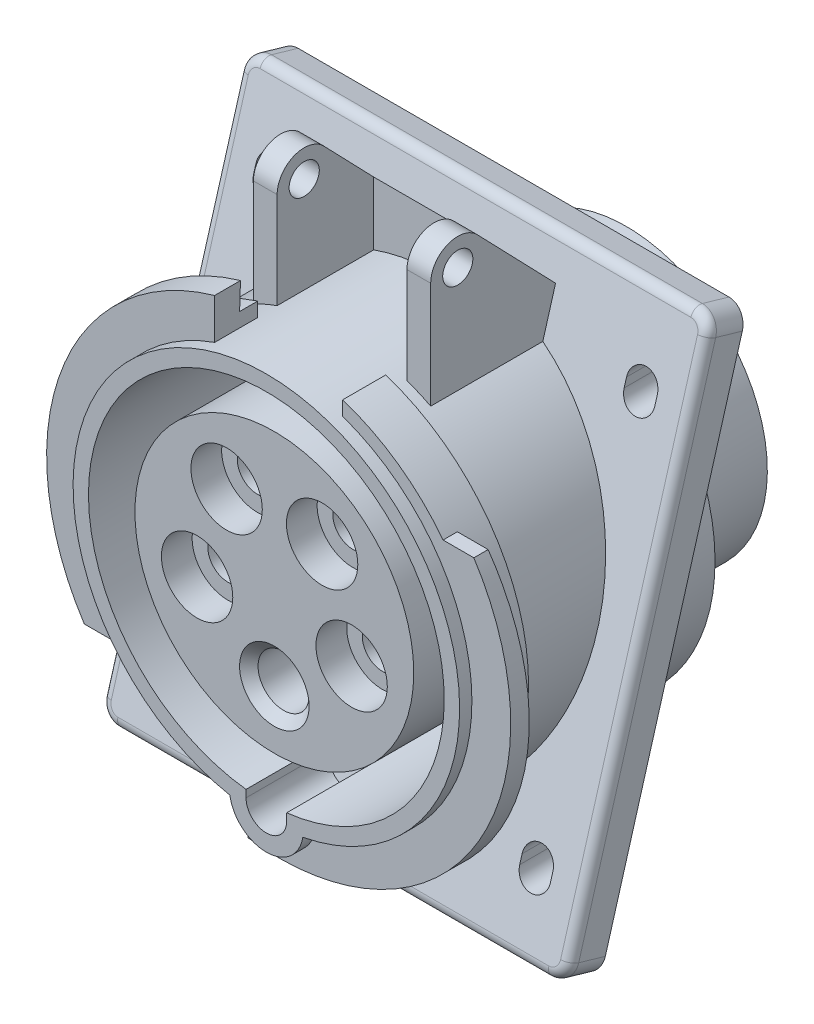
SolidWorks part; units mm, degrees
ref_plane "Спереди" through (0, 0, 0) normal (0, 0, 1) x (1, 0, 0)
ref_plane "Сверху" through (0, 0, 0) normal (0, 1, 0) x (1, 0, 0)
ref_plane "Справа" through (0, 0, 0) normal (1, 0, 0) x (0, 0, -1)
sketch "Эскиз1" plane through (0, 0, 0) normal (0, 0, 1) x (1, 0, 0)
  line L0 (-30.35, 30.35) -> (-30.35, -30.35) construction
  line L1 (-37.25, -37.25) -> (37.25, -37.25)
  line L2 (-37.25, -37.25) -> (-37.25, 37.25)
  line L3 (-37.25, 37.25) -> (37.25, 37.25)
  line L4 (37.25, -37.25) -> (37.25, 37.25)
  line L5 (-37.25, -37.25) -> (37.25, 37.25) construction
  line L6 (-37.25, 37.25) -> (37.25, -37.25) construction
  line L7 (-30.35, -30.35) -> (30.35, -30.35) construction
  line L8 (30.35, -30.35) -> (30.35, 30.35) construction
  line L9 (30.35, 30.35) -> (-30.35, 30.35) construction
  circle A0 centre (-30.35, 30.35) radius 2.4
  circle A1 centre (30.35, 30.35) radius 2.4
  circle A2 centre (30.35, -30.35) radius 2.4
  circle A3 centre (-30.35, -30.35) radius 2.4
  point P0 (0, 0)
  dimension "D3" = 4.8
  dimension "D1" = 74.5
  dimension "D2" = 74.5
  dimension "D4" = 60.7
extrude "Бобышка-Вытянуть1" add sketch "Эскиз1" along normal blind 9.8
sketch "Эскиз2" plane through (0, 0, 9.8) normal (0, 0, 1) x (1, 0, 0)
  circle A0 centre (0, 0) radius 31.4
  dimension "D1" = 62.8
extrude "Бобышка-Вытянуть2" add sketch "Эскиз2" along normal blind 40.7
sketch "Эскиз3" plane through (0, 0, 50.5) normal (0, 0, 1) x (1, 0, 0)
  circle A0 centre (0, 0) radius 28.9
  circle A1 centre (0, 0) radius 22.65
  dimension "D1" = 57.8
  dimension "D2" = 45.3
extrude "Вырез-Вытянуть1" cut sketch "Эскиз3" against normal blind 39
sketch "Эскиз4" plane through (0, 0, 50.5) normal (0, 0, 1) x (1, 0, 0)
  circle A0 centre (0, 0) radius 22.65
  dimension "D1" = 45.3
extrude "Вырез-Вытянуть2" cut sketch "Эскиз4" against normal blind 1.3
sketch "Эскиз5" plane through (0, 0, 49.2) normal (0, 0, 1) x (1, 0, 0)
  line L0 (0, 0) -> (0, -13.2) construction
  line L1 (12.5539, -4.079) -> (-12.5539, -4.079) construction
  line L2 (-7.7588, 10.679) -> (7.7588, 10.679) construction
  circle A0 centre (0, -13.2) radius 4.15
  circle A8 centre (-7.7588, 10.679) radius 5.8
  circle A9 centre (7.7588, 10.679) radius 5.8
  circle A10 centre (-12.5539, -4.079) radius 5.8
  circle A11 centre (12.5539, -4.079) radius 5.8
  point P15 (0, 0)
  dimension "D1" = 8.3
  dimension "D4" = 11.6
  dimension "D2" = 15.5175
  dimension "D3" = 13.2
  dimension "D5" = 14.758
  dimension "D7" = 7.7588
  dimension "D8" = 10.679
  dimension "D9" = 25.1079
  dimension "D10" = 12.5539
extrude "Вырез-Вытянуть3" cut sketch "Эскиз5" against normal blind 5
sketch "Эскиз6" plane through (0, 0, 44.2) normal (0, 0, 1) x (1, 0, 0)
  circle A0 centre (-7.7588, 10.679) radius 3.25
  circle A1 centre (7.7588, 10.679) radius 3.25
  circle A2 centre (-12.5539, -4.079) radius 3.25
  circle A3 centre (12.5539, -4.079) radius 3.25
  circle A4 centre (0, -13.2) radius 4.15
  dimension "D1" = 6.5
  dimension "D2" = 8.3
extrude "Вырез-Вытянуть4" cut sketch "Эскиз6" against normal blind 20
chamfer "Фаска1" distance 1.5 angle 45 1 edges at (4.15, -13.2, 49.2)
sketch "Эскиз7" plane through (0, 0, 9.8) normal (0, 0, 1) x (1, 0, 0)
  arc A0 (-5.9266, -30.8356) -> (5.9266, -30.8356) centre (0, -29.9) ccw
  circle A3 centre (0, 0) radius 31.4 construction
  circle A4 centre (0, 0) radius 31.4 construction
  arc A5 (-5.9266, -30.8356) -> (5.9266, -30.8356) centre (0, 0) ccw
  point P2 (0, -31.4)
  point P4 (0, -35.9)
  dimension "D1" = 12
  dimension "D2" = 4.5
  dimension "D3" = 11.8532
extrude "Бобышка-Вытянуть3" add sketch "Эскиз7" along normal up to surface (40.7 mm away)
sketch "Эскиз8" plane through (0, 0, 50.5) normal (0, 0, 1) x (1, 0, 0)
  line L0 (-3.3, -29.9) -> (-3.3, -28.711)
  line L1 (3.3, -29.9) -> (3.3, -28.711)
  circle A1 centre (0, 0) radius 28.9 construction
  arc A2 (-3.2596, -30.4146) -> (3.2596, -30.4146) centre (0, -29.9) ccw
  arc A3 (-3.3, -29.9) -> (3.3, -29.9) centre (0, -29.9) ccw
  arc A4 (-3.3, -28.711) -> (3.3, -28.711) centre (0, 0) ccw
  dimension "D1" = 2.7
extrude "Вырез-Вытянуть5" cut sketch "Эскиз8" against normal up to surface (39 mm away)
ref_plane "Плоскость1" through (0, 0, 48.5) normal (0, 0, 1) x (1, 0, 0)
sketch "Эскиз9" plane through (0, 0, 48.5) normal (0, 0, 1) x (1, 0, 0)
  circle A0 centre (0, 0) radius 37.7
  arc A1 (-5.9266, -30.8356) -> (5.9266, -30.8356) centre (0, -29.9) ccw construction
  arc A2 (5.9266, -30.8356) -> (-5.9266, -30.8356) centre (0, 0) ccw construction
  arc A3 (-5.9266, -30.8356) -> (5.9266, -30.8356) centre (0, -29.9) ccw
  arc A4 (5.9266, -30.8356) -> (-5.9266, -30.8356) centre (0, 0) ccw
  dimension "D1" = 75.4
extrude "Бобышка-Вытянуть4" add sketch "Эскиз9" against normal blind 4.3
sketch "Эскиз10" plane through (0, 0, 44.2) normal (0, 0, -1) x (-1, 0, 0)
  line L0 (-3.3, -29.9) -> (-3.3, -28.711) construction
  line L1 (3.3, -28.711) -> (3.3, -29.9) construction
  line L2 (-3.3, -29.9) -> (-3.3, -28.711)
  line L3 (3.3, -28.711) -> (3.3, -29.9)
  circle A0 centre (0, 0) radius 33.6
  arc A1 (3.3, -28.711) -> (-3.3, -28.711) centre (0, 0) ccw
  arc A2 (-3.3, -29.9) -> (3.3, -29.9) centre (0, -29.9) ccw construction
  arc A3 (-3.3, -29.9) -> (3.3, -29.9) centre (0, -29.9) ccw
  dimension "D1" = 67.2
extrude "Бобышка-Вытянуть5" add sketch "Эскиз10" along normal blind 2.7
sketch "Эскиз11" plane through (0, 0, 48.5) normal (0, 0, 1) x (1, 0, 0)
  line L0 (-10.4, 36.2371) -> (-10.4, 29.6277)
  line L1 (-4.9932, -33.2269) -> (-4.9932, -37.3679)
  line L2 (-10.4, 39.443) -> (10.4, 39.443) construction
  line L3 (26.7136, 20.3799) -> (31.7167, 20.3799)
  line L4 (10.4, 31.95) -> (10.4, 29.6277)
  line L5 (-26.5589, -20.5811) -> (-31.5865, -20.5811)
  arc A0 (5.9266, -30.8356) -> (-5.9266, -30.8356) centre (0, 0) ccw construction
  arc A1 (5.9266, -30.8356) -> (-5.9266, -30.8356) centre (0, 0) ccw construction
  circle A2 centre (0, 0) radius 37.7 construction
  arc A4 (10.4, 29.6277) -> (-10.4, 29.6277) centre (0, 0) ccw
  arc A5 (4.9932, -33.2269) -> (-4.9932, -33.2269) centre (0, 0) ccw construction
  arc A6 (26.7136, 20.3799) -> (10.4, 31.95) centre (0, 0) ccw
  arc A7 (-26.5589, -20.5811) -> (-4.9932, -33.2269) centre (0, 0) ccw
  arc A8 (-31.5865, -20.5811) -> (-4.9932, -37.3679) centre (0, 0) ccw
  arc A9 (31.7167, 20.3799) -> (-10.4, 36.2371) centre (0, 0) ccw
  point P10 (0, 39.443)
  dimension "D1" = 20.8
  dimension "D2" = 20
  dimension "D3" = 10.4
  dimension "D4" = 25
extrude "Вырез-Вытянуть6" cut sketch "Эскиз11" against normal up to next
sketch "Эскиз12" plane through (0, 0, 44.2) normal (0, 0, -1) x (-1, 0, 0)
  line L0 (0, -37.7) -> (0, -35.9)
  line L1 (4.9932, -33.2269) -> (4.9932, -37.3679) construction
  line L2 (4.9932, -33.2269) -> (4.9932, -37.3679)
  arc A0 (-31.7167, 20.3799) -> (4.9932, -37.3679) centre (0, 0) ccw construction
  arc A1 (-4.9932, -33.2269) -> (4.9932, -33.2269) centre (0, -29.9) ccw construction
  arc A2 (0, -37.7) -> (4.9932, -37.3679) centre (0, 0) ccw
  arc A3 (0, -35.9) -> (4.9932, -33.2269) centre (0, -29.9) ccw
extrude "Вырез-Вытянуть7" cut sketch "Эскиз12" against normal blind 2.3
sketch "Эскиз13" plane through (0, 0, 44.2) normal (0, 0, -1) x (-1, 0, 0)
  line L0 (0, -37.7) -> (0, -35.9)
  line L1 (-2, -37.6469) -> (-2, -35.5569)
  arc A0 (-4.9932, -33.2269) -> (0, -35.9) centre (0, -29.9) ccw construction
  arc A1 (-2, -35.5569) -> (0, -35.9) centre (0, -29.9) ccw
  arc A2 (-31.7167, 20.3799) -> (0, -37.7) centre (0, 0) ccw construction
  arc A3 (-2, -37.6469) -> (0, -37.7) centre (0, 0) ccw
  dimension "D1" = 2
extrude "Бобышка-Вытянуть6" add sketch "Эскиз13" along normal blind 2.5
sketch "Эскиз14" plane through (0, 0, 0) normal (0, 0, -1) x (-1, 0, 0)
  circle A0 centre (0, 0) radius 25.95
  dimension "D1" = 51.9
extrude "Вырез-Вытянуть8" cut sketch "Эскиз14" against normal blind 9.3
fillet "Скругление1" radius 3 4 edges at (37.25, -37.25, 4.9) (-37.25, -37.25, 4.9) (37.25, 37.25, 4.9) (-37.25, 37.25, 4.9)
fillet "Скругление2" radius 1.5 8 edges at (-36.3713, 36.3713, 9.8) (0, 37.25, 9.8) (36.3713, 36.3713, 9.8) (37.25, 0, 9.8) (36.3713, -36.3713, 9.8) (0, -37.25, 9.8) (-36.3713, -36.3713, 9.8) (-37.25, 0, 9.8)
ref_plane "Плоскость2" through (0, 0, 0) normal (-1, 0, 0) x (0, 0, 1)
sketch "Эскиз16" plane through (0, 0, 0) normal (-1, 0, 0) x (0, 0, 1)
  line L0 (2.8964, 49.6) -> (40.8362, 49.6) construction
  line L1 (50.5, 31.4) -> (9.8, 31.4) construction
  line L2 (38.2, 27.9) -> (38.2, 45.2)
  line L3 (41.5, 31.95) -> (41.5, -33.2269) construction
  line L4 (11, 27.9) -> (30.6331, 48.2546)
  line L5 (11, 27.9) -> (38.2, 27.9)
  line L6 (9.8, -30.8356) -> (9.8, 31.4) construction
  arc A0 (38.2, 45.2) -> (30.6331, 48.2546) centre (33.8, 45.2) ccw
  circle A1 centre (33.8, 45.2) radius 2.45
  dimension "D3" = 8.8
  dimension "D6" = 4.9
  dimension "D1" = 18.2
  dimension "D2" = 3.3
  dimension "D4" = 21.7
  dimension "D5" = 1.2
extrude "Бобышка-Вытянуть8" add sketch "Эскиз16" along normal mid plane 28.8
ref_plane "Плоскость3" through (0, 49.6, 0) normal (0, 1, 0) x (1, 0, 0)
sketch "Эскиз19" plane through (0, 49.6, 0) normal (0, 1, 0) x (1, 0, 0)
  line L0 (-10.55, -38.2) -> (10.55, -38.2)
  line L1 (-14.4, -38.2) -> (14.4, -38.2) construction
  line L2 (10.55, -38.2) -> (10.55, -22.5)
  line L3 (10.55, -22.5) -> (-10.55, -22.5)
  line L4 (-10.55, -22.5) -> (-10.55, -38.2)
  line L5 (0, 4.565) -> (0, -4.565) construction
  point P4 (0, -22.5)
  dimension "D1" = 21.1
  dimension "D2" = 15.7
extrude "Вырез-Вытянуть9" cut sketch "Эскиз19" against normal up to surface (20.0254 mm away)
ref_plane "Плоскость6" through (0, 0.364, 10.9739) normal (0, -0.0332, -0.9995) x (-1, 0, 0)
ref_plane "Плоскость7" through (0, 1.5079, 45.4549) normal (0, 0.0332, 0.9995) x (1, 0, 0)
sketch "Эскиз29" plane through (0, 0, 44.2) normal (0, 0, -1) x (-1, 0, 0)
  line L2 (10.4, 36.2371) -> (10.4, 31.95)
  line L3 (26.5589, -20.5811) -> (31.5865, -20.5811)
  line L4 (10.4, 36.2371) -> (10.4, 31.95)
  line L5 (26.5589, -20.5811) -> (31.5865, -20.5811)
  arc A2 (31.5865, -20.5811) -> (10.4, 36.2371) centre (0, 0) ccw
  arc A3 (26.5589, -20.5811) -> (10.4, 31.95) centre (0, 0) ccw
  arc A4 (31.5865, -20.5811) -> (10.4, 36.2371) centre (0, 0) ccw
  arc A5 (26.5589, -20.5811) -> (10.4, 31.95) centre (0, 0) ccw
  dimension "D1" = 0
extrude "Вырез-Вытянуть15" cut sketch "Эскиз29" against normal up to surface (1.9877 mm away)
ref_plane "Плоскость8" through (0, -0.364, 10.9739) normal (0, -0.0332, 0.9995) x (1, 0, 0)
ref_plane "Плоскость9" through (0, -1.5079, 45.4549) normal (0, -0.0332, 0.9995) x (1, 0, 0)
sketch "Эскиз30" plane through (0, 0, 44.2) normal (0, 0, -1) x (-1, 0, 0)
  line L2 (-2, -37.6469) -> (-2, -35.5569)
  line L3 (-26.7136, 20.3799) -> (-31.7167, 20.3799)
  line L4 (-2, -37.6469) -> (-2, -35.5569)
  line L5 (-26.7136, 20.3799) -> (-31.7167, 20.3799)
  arc A3 (-4.9932, -33.2269) -> (-2, -35.5569) centre (0, -29.9) ccw
  arc A4 (-26.7136, 20.3799) -> (-4.9932, -33.2269) centre (0, 0) ccw
  arc A5 (-31.7167, 20.3799) -> (-2, -37.6469) centre (0, 0) ccw
  arc A6 (-4.9932, -33.2269) -> (-2, -35.5569) centre (0, -29.9) ccw
  arc A7 (-26.7136, 20.3799) -> (-4.9932, -33.2269) centre (0, 0) ccw
  arc A8 (-31.7167, 20.3799) -> (-2, -37.6469) centre (0, 0) ccw
  dimension "D1" = 0
extrude "Вырез-Вытянуть16" cut sketch "Эскиз30" against normal up to surface (1.981 mm away)
ref_plane "Плоскость10" through (0, 5.3843, 18.5933) normal (0, 0.2782, 0.9605) x (-1, 0, 0)
ref_plane "Плоскость12" through (0, 0, 0) normal (1, 0, 0) x (0, 0, -1)
sketch "Эскиз34" plane through (0, 0, 0) normal (1, 0, 0) x (0, 0, -1)
  line L0 (-16.1014, 41.3031) -> (-40.0226, -41.3031)
  line L1 (-53.4837, -41.3031) -> (0, -41.3031) construction
  line L2 (-53.162, 41.3031) -> (0, 41.3031) construction
  line L3 (-41.5, -30.8356) -> (-41.5, 29.6277) construction
  line L4 (-50.5, 31.4) -> (-50.5, -30.8356) construction
  line L5 (0, 41.3031) -> (0, -41.3031) construction
  line L6 (-16.1014, 41.3031) -> (-10.3382, 39.6342)
  line L7 (-10.3382, 39.6342) -> (-34.2594, -42.972)
  line L8 (-34.2594, -42.972) -> (-40.0226, -41.3031)
  point P5 (0, 0)
  dimension "D1" = 10.4774
  dimension "D2" = 6
  dimension "D3" = 16.15
  dimension "D4" = 86
extrude "Бобышка-Вытянуть13" add sketch "Эскиз34" along normal mid plane 76
sketch "Эскиз36" plane through (0, 0, 0) normal (0, 0, -1) x (-1, 0, 0)
  line L0 (-34.25, 37.25) -> (34.25, 37.25) construction
  line L1 (-37.25, -37.25) -> (37.25, -37.25)
  line L2 (-37.25, -37.25) -> (-37.25, 37.25)
  line L3 (-37.25, 37.25) -> (37.25, 37.25)
  line L4 (37.25, -37.25) -> (37.25, 37.25)
  line L5 (-37.25, -37.25) -> (37.25, 37.25) construction
  line L6 (-37.25, 37.25) -> (37.25, -37.25) construction
  line L7 (37.25, 34.25) -> (37.25, -34.25) construction
  circle A0 centre (0, 0) radius 25.95
  point P0 (0, 0)
extrude "Вырез-Вытянуть17" cut sketch "Эскиз36" against normal up to surface (9.8 mm away) contours L3 L4 L1 L2
sketch "Эскиз39" plane through (0, 0, 9.8) normal (0, 0, -1) x (-1, 0, 0)
  line L0 (14.4, 30.0817) -> (9.0027, 30.0817) construction
  line L1 (14.4, 27.9034) -> (14.4, 30.0817) construction
  line L2 (-9.0027, 30.0817) -> (-14.4, 30.0817) construction
  line L3 (-14.4, 30.0817) -> (-14.4, 27.9034) construction
  line L4 (14.4, 30.0817) -> (9.0027, 30.0817)
  line L5 (14.4, 27.9034) -> (14.4, 30.0817)
  line L6 (-9.0027, 30.0817) -> (-14.4, 30.0817)
  line L7 (-14.4, 30.0817) -> (-14.4, 27.9034)
  arc A0 (14.4, 27.9034) -> (9.0027, 30.0817) centre (0, 0) ccw construction
  arc A1 (-9.0027, 30.0817) -> (-14.4, 27.9034) centre (0, 0) ccw construction
  arc A2 (14.4, 27.9034) -> (9.0027, 30.0817) centre (0, 0) ccw
  arc A3 (-9.0027, 30.0817) -> (-14.4, 27.9034) centre (0, 0) ccw
extrude "Вырез-Вытянуть18" cut sketch "Эскиз39" against normal up to surface (3.3044 mm away)
sketch "Эскиз40" plane through (0, 0, 9.8) normal (0, 0, -1) x (-1, 0, 0)
  arc A2 (5.9266, -30.8356) -> (-5.9266, -30.8356) centre (0, 0) ccw
  arc A3 (-5.9266, -30.8356) -> (5.9266, -30.8356) centre (0, -29.9) ccw
  arc A4 (5.9266, -30.8356) -> (-5.9266, -30.8356) centre (0, 0) ccw
  arc A5 (-5.9266, -30.8356) -> (5.9266, -30.8356) centre (0, -29.9) ccw
  dimension "D1" = 0
extrude "Бобышка-Вытянуть14" add sketch "Эскиз40" along normal blind 0.8
sketch "Эскиз41" plane through (0, 0, 9) normal (0, 0, -1) x (-1, 0, 0)
  circle A0 centre (0, 0) radius 22.9
  dimension "D1" = 45.8
extrude "Бобышка-Вытянуть15" add sketch "Эскиз41" along normal blind 17
ref_plane "Плоскость13" through (0, 0, -11) normal (0, 0, -1) x (-1, 0, 0)
sketch "Эскиз42" plane through (0, 0, -11) normal (0, 0, -1) x (-1, 0, 0)
  line L0 (-4.7, -17.1664) -> (-4.7, -24.25)
  line L1 (-4.7, -24.25) -> (4.7, -24.25)
  line L2 (4.7, -24.25) -> (4.7, -17.1664)
  line L3 (-9.65, 3.179) -> (9.65, 3.179) construction
  arc A2 (4.7, -17.1664) -> (-4.7, -17.1664) centre (0, -13.2) ccw
  circle A3 centre (-9.65, 3.179) radius 4.5
  circle A4 centre (9.65, 3.179) radius 4.5
  point P6 (0, -24.25)
  point P13 (0, 3.179)
  point P14 (-7.7588, 10.679)
  dimension "D1" = 12.3
  dimension "D4" = 9
  dimension "D2" = 11.05
  dimension "D3" = 9.4
  dimension "D5" = 19.3
  dimension "D6" = 7.5
extrude "Бобышка-Вытянуть16" add sketch "Эскиз42" against normal up to surface (3 mm away)
sketch "Эскиз43" plane through (0, 0, -11) normal (0, 0, -1) x (-1, 0, 0)
  circle A0 centre (0, -13.2) radius 2.6
  circle A1 centre (-12.5539, -4.079) radius 2.6
  circle A2 centre (-7.7588, 10.679) radius 2.6
  circle A3 centre (7.7588, 10.679) radius 2.6
  circle A4 centre (12.5539, -4.079) radius 2.6
  dimension "D1" = 5.2
extrude "Вырез-Вытянуть19" cut sketch "Эскиз43" against normal blind 17
fillet "Скругление3" radius 1 2 edges at (-14.15, 3.179, -11) (5.15, 3.179, -11)
sketch "Эскиз44" plane through (0, 0, -8) normal (0, 0, -1) x (-1, 0, 0)
  line L0 (10.957, -10.9474) -> (11.257, -10.9474)
  line L1 (10.957, -10.9474) -> (10.957, -13.9474)
  line L2 (11.257, -10.9474) -> (11.257, -13.9474)
  line L3 (11.257, -13.9474) -> (14.307, -13.9474)
  line L4 (7.907, -13.9474) -> (10.957, -13.9474)
  line L5 (7.907, -13.9474) -> (7.907, -14.2474)
  line L6 (7.907, -14.2474) -> (14.307, -14.2474)
  line L7 (14.307, -13.9474) -> (14.307, -14.2474)
  line L8 (9.157, -15.0474) -> (13.057, -15.0474)
  line L9 (9.157, -15.0474) -> (9.157, -15.3474)
  line L10 (9.157, -15.3474) -> (13.057, -15.3474)
  line L11 (13.057, -15.0474) -> (13.057, -15.3474)
  line L12 (10.0238, -16.1474) -> (12.1238, -16.1474)
  line L13 (10.0238, -16.1474) -> (10.0238, -16.4474)
  line L14 (10.0238, -16.4474) -> (12.1238, -16.4474)
  line L15 (12.1238, -16.1474) -> (12.1238, -16.4474)
  point P4 (11.107, -10.9474)
  point P13 (11.107, -15.0474)
  point P14 (11.107, -14.2474)
  point P15 (11.0738, -16.1474)
  point P16 (11.107, -15.3474)
  dimension "D1" = 0.3
  dimension "D2" = 3
  dimension "D3" = 6.4
  dimension "D4" = 0.3
  dimension "D5" = 0.3
  dimension "D6" = 0.8
  dimension "D7" = 3.9
  dimension "D8" = 2.1
  dimension "D9" = 0.3
  dimension "D10" = 0.8
extrude "Бобышка-Вытянуть17" add sketch "Эскиз44" along normal blind 0.1
sketch "Эскиз45" plane through (0, 0, -8) normal (0, 0, -1) x (-1, 0, 0)
  text T0 "L1" font "Arial" height 2.5
  text T1 "L2" font "Arial" height 2.5
  text T2 "L3" font "Arial" height 2.5
  text T3 "N" font "Arial" height 2.5
  point P4 (0, 0)
  point P5 (0, 0)
extrude "Бобышка-Вытянуть18" add sketch "Эскиз45" along normal blind 0.1
fillet "Скругление4" radius 3 4 edges at (38, -42.1375, 37.141) (-38, -42.1375, 37.141) (-38, 40.4686, 13.2198) (38, 40.4686, 13.2198)
fillet "Скругление5" radius 1.5 8 edges at (37.1213, 40.4591, 16.3458) (0, 41.3031, 16.1014) (-37.1213, 40.4591, 16.3458) (-38, 0, 28.062) (-37.1213, -40.4591, 39.7782) (0, -41.3031, 40.0226) (37.1213, -40.4591, 39.7782) (38, 0, 28.062)
sketch "Эскиз46" plane through (0, 0, 50.5) normal (0, 0, 1) x (1, 0, 0)
  circle A0 centre (0, 0) radius 28.9
  circle A1 centre (0, 0) radius 22.65
extrude "Вырез-Вытянуть20" cut sketch "Эскиз46" against normal blind 37.8
sketch "Эскиз47" plane through (0, 0, 12.7) normal (0, 0, 1) x (1, 0, 0)
  line L1 (-7.5366, 27.9) -> (7.5366, 27.9)
  line L2 (-7.5366, 27.9) -> (7.5366, 27.9)
  arc A1 (7.5366, 27.9) -> (-7.5366, 27.9) centre (0, 0) ccw
  arc A2 (7.5366, 27.9) -> (-7.5366, 27.9) centre (0, 0) ccw
  dimension "D1" = 0
extrude "Вырез-Вытянуть21" cut sketch "Эскиз47" against normal up to surface (1.2 mm away)
sketch "Эскиз48" plane through (0, 0, 49.2) normal (0, 0, 1) x (1, 0, 0)
  circle A0 centre (-7.7588, 10.679) radius 3.25
  circle A1 centre (7.7588, 10.679) radius 3.25
  circle A2 centre (12.5539, -4.079) radius 3.25
  circle A3 centre (-12.5539, -4.079) radius 3.25
  circle A4 centre (0, -13.2) radius 4.15
extrude "Вырез-Вытянуть22" cut sketch "Эскиз48" against normal up to surface (25 mm away)
sketch "Эскиз50" plane through (0, 7.4975, 25.8909) normal (0, 0.2782, 0.9605) x (1, 0, 0)
  line L0 (-30.1, 22.6945) -> (-30.1, 21.2945) construction
  line L1 (-27.6, 22.6945) -> (-27.6, 21.2945)
  line L2 (-32.6, 22.6945) -> (-32.6, 21.2945)
  line L3 (-35, 35.1945) -> (35, 35.1945) construction
  line L4 (-38, -47.8055) -> (-38, 32.1945) construction
  arc A0 (-27.6, 22.6945) -> (-32.6, 22.6945) centre (-30.1, 22.6945) ccw
  arc A1 (-32.6, 21.2945) -> (-27.6, 21.2945) centre (-30.1, 21.2945) ccw
  point P2 (-30.1, 21.9945)
  point P7 (-30.1, 25.1945)
  point P12 (-30.1, 18.7945)
  dimension "D1" = 10
  dimension "D2" = 5.4
  dimension "D3" = 5
  dimension "D4" = 6.4
ref_plane "Плоскость14" through (-30.1, 0, 0) normal (-1, 0, 0) x (0, 0, 1)
sketch "Эскиз51" plane through (-30.1, 0, 0) normal (-1, 0, 0) x (0, 0, 1)
  line L0 (19.773, 28.624) -> (13.5265, 28.624)
  line L1 (33.4249, -40.0904) -> (11.1727, 36.7526) construction
sweep "Вырез-По траектории1" cut profiles "Эскиз50" path "Эскиз51"
ref_plane "Плоскость15" through (0, 0, 0) normal (-1, 0, 0) x (0, 0, 1)
ref_plane "Плоскость16" through (0, -7.4975, 2.1711) normal (0, -0.9605, 0.2782) x (-1, 0, 0)
pattern_linear "Линейный массив1" count 2 spacing 61 along (0, -0.9605, 0.2782) of "Вырез-По траектории1"
mirror "Зеркальное отражение3" about plane through (0, 0, 0) normal (-1, 0, 0) of "Линейный массив1", "Вырез-По траектории1"
